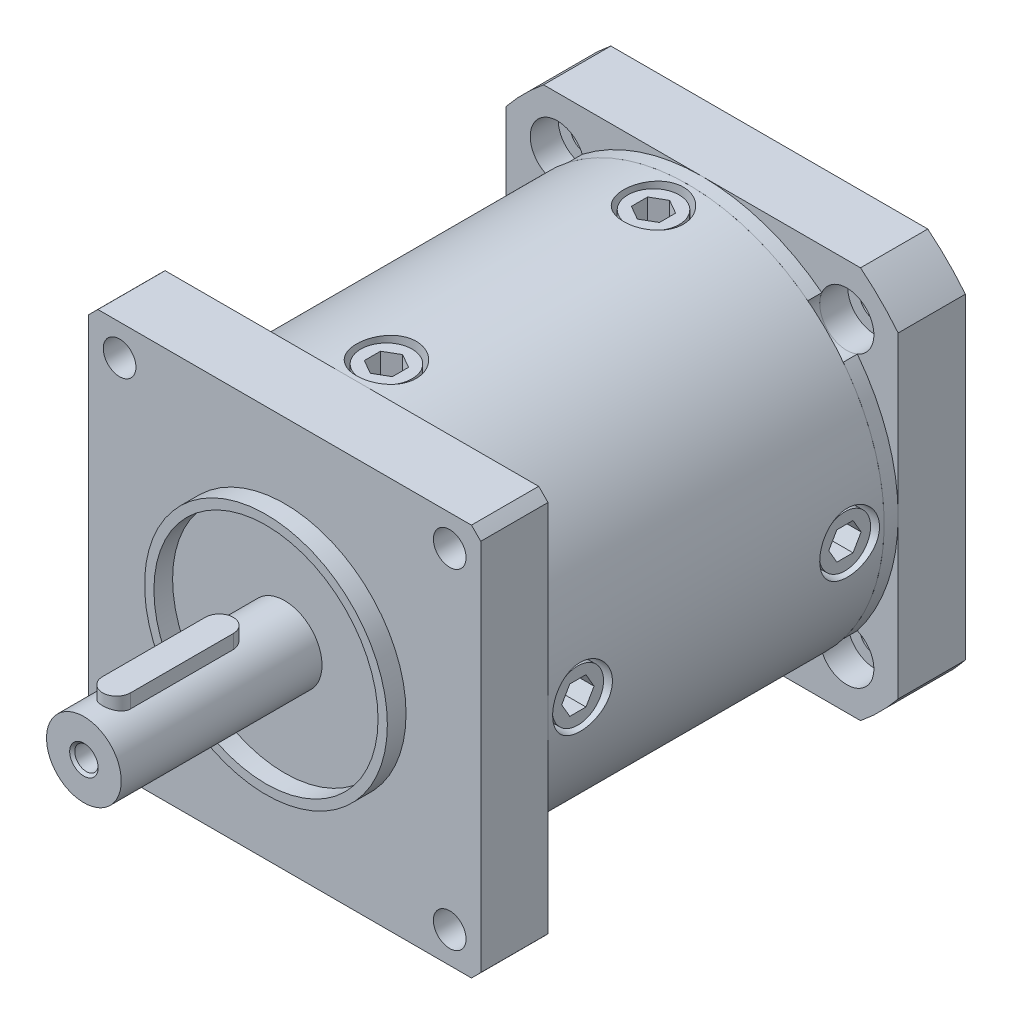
SolidWorks part; units mm, degrees
ref_plane "前视基准面" through (0, 0, 0) normal (0, 0, 1) x (1, 0, 0)
ref_plane "上视基准面" through (0, 0, 0) normal (0, 1, 0) x (1, 0, 0)
ref_plane "右视基准面" through (0, 0, 0) normal (1, 0, 0) x (0, 0, -1)
sketch "草图1" plane through (0, 0, 0) normal (0, 0, 1) x (1, 0, 0)
  line L1 (-20, -21) -> (20, -21)
  line L2 (-21, -20) -> (-21, 20)
  line L3 (-20, 21) -> (20, 21)
  line L4 (21, -20) -> (21, 20)
  line L5 (0, 21) -> (0, -21) construction
  line L6 (-21, 0) -> (21, 0) construction
  arc A0 (-20, 21) -> (-21, 20) centre (0, 0) ccw
  arc A1 (21, 20) -> (20, 21) centre (0, 0) ccw
  arc A2 (20, -21) -> (21, -20) centre (0, 0) ccw
  arc A3 (-21, -20) -> (-20, -21) centre (0, 0) ccw
  arc A4 (-21, -13.5647) -> (-21, 13.5647) centre (0, 0) ccw construction
  circle A5 centre (-17.6777, 17.6777) radius 1.75
  circle A6 centre (17.6777, 17.6777) radius 1.75
  circle A7 centre (17.6777, -17.6777) radius 1.75
  circle A8 centre (-17.6777, -17.6777) radius 1.75
  point P0 (0, 0)
  point P25 (0, 0)
  dimension "D3" = 3.5
  dimension "D4" = 4
extrude "凸台-拉伸2" add sketch "草图1" along normal blind 7.2
sketch "草图15" plane through (0, 0, 0) normal (0, 0, -1) x (-1, 0, 0)
  circle A0 centre (0, 0) radius 21
  dimension "D1" = 42
extrude "凸台-拉伸8" add sketch "草图15" along normal blind 36
sketch "草图17" plane through (0, 0, 7.2) normal (0, 0, 1) x (1, 0, 0)
  circle A0 centre (0, 0) radius 13
  circle A1 centre (0, 0) radius 12
  dimension "D1" = 26
  dimension "D2" = 24
extrude "凸台-拉伸9" add sketch "草图17" along normal blind 2
sketch "草图18" plane through (0, 0, 7.2) normal (0, 0, 1) x (1, 0, 0)
  circle A0 centre (0, 0) radius 4
  dimension "D1" = 8
extrude "凸台-拉伸10" add sketch "草图18" along normal blind 21.5
hole_wizard "M3 螺纹孔1" positions "草图22" profile "草图23" tap size "M3" standard "GB"
sketch "草图22" plane through (0, 0, 28.7) normal (0, 0, 1) x (1, 0, 0)
  point P0 (0, 0)
sketch "草图23" plane through (0, 0, 28.7) normal (1, 0, 0) x (0, -1, 0)
  line L0 (0, 0) -> (0, 11.7511)
  line L1 (0, 11.7511) -> (1.25, 11)
  line L2 (1.25, 11) -> (1.25, 0.275)
  line L3 (1.25, 0.275) -> (1.525, 0)
  line L5 (1.525, 0) -> (0, 0)
  line L6 (-1.25, 0.275) -> (-1.525, 0) construction
  line L10 (0, 11.7511) -> (-1.25, 11) construction
  line L11 (0, -6.35) -> (0, 107.95) construction
  dimension "螺纹孔钻头直径" = 2.5
  dimension "螺纹孔钻头深度" = 11
  dimension "近端锥形沉头孔直径" = 3.05
  dimension "近端锥形沉头孔角度" = 90
  dimension "导头角度" = 118
sketch "草图24" plane through (0, 0, 0) normal (0, 1, 0) x (1, 0, 0)
  line L0 (0, -14.2) -> (0, -25.2) construction
  line L2 (1.5, -14.2) -> (1.5, -25.2)
  line L3 (-1.5, -14.2) -> (-1.5, -25.2)
  line L4 (-4, -28.7) -> (4, -28.7) construction
  arc A0 (1.5, -14.2) -> (-1.5, -14.2) centre (0, -14.2) ccw
  arc A1 (-1.5, -25.2) -> (1.5, -25.2) centre (0, -25.2) ccw
  point P5 (0, -19.7)
  dimension "D1" = 3
  dimension "D2" = 11
  dimension "D3" = 3.5
extrude "凸台-拉伸11" add sketch "草图24" along normal blind 3 from offset 2.2
sketch "草图25" plane through (0, 0, -36) normal (0, 0, -1) x (-1, 0, 0)
  circle A0 centre (0, 0) radius 21
  dimension "D1" = 42
extrude "凸台-拉伸12" add sketch "草图25" along normal blind 1.5 separate body
sketch "草图26" plane through (0, 0, -37.5) normal (0, 0, -1) x (-1, 0, 0)
  line L1 (-16.9706, 21) -> (16.9706, 21)
  line L2 (-21, 16.9706) -> (-21, -16.9706)
  line L3 (-16.9706, -21) -> (16.9706, -21)
  line L4 (21, 16.9706) -> (21, -16.9706)
  line L5 (0, -21) -> (0, 21) construction
  line L6 (-21, 0) -> (21, 0) construction
  line L7 (-15.5, 15.5) -> (15.5, 15.5) construction
  line L8 (-15.5, 15.5) -> (-15.5, -15.5) construction
  line L9 (-15.5, -15.5) -> (15.5, -15.5) construction
  line L10 (15.5, 15.5) -> (15.5, -15.5) construction
  line L11 (0, -15.5) -> (0, 15.5) construction
  line L12 (-15.5, 0) -> (15.5, 0) construction
  arc A0 (16.9706, -21) -> (21, -16.9706) centre (0, 0) ccw
  arc A1 (-21, -16.9706) -> (-16.9706, -21) centre (0, 0) ccw
  arc A2 (-16.9706, 21) -> (-21, 16.9706) centre (0, 0) ccw
  arc A3 (21, 16.9706) -> (16.9706, 21) centre (0, 0) ccw
  circle A4 centre (-15.5, 15.5) radius 1.6
  circle A5 centre (15.5, 15.5) radius 1.6
  circle A6 centre (15.5, -15.5) radius 1.6
  circle A7 centre (-15.5, -15.5) radius 1.6
  point P0 (0, 0)
  point P22 (0, 0)
  dimension "D3" = 54
  dimension "D4" = 3.2
  dimension "D1" = 31
  dimension "D2" = 31
  dimension "D5" = 4
extrude "凸台-拉伸13" add sketch "草图26" along normal blind 7.2 separate body
sketch "草图27" plane through (0, 0, -44.7) normal (0, 0, -1) x (-1, 0, 0)
  circle A0 centre (0, 0) radius 11
  dimension "D1" = 22
extrude "切除-拉伸1" cut sketch "草图27" against normal blind 3
sketch "草图28" plane through (0, 0, -41.7) normal (0, 0, -1) x (-1, 0, 0)
  circle A0 centre (0, 0) radius 10
  dimension "D1" = 20
extrude "切除-拉伸2" cut sketch "草图28" against normal blind 10
sketch "草图29" plane through (0, 0, -31.7) normal (0, 0, -1) x (-1, 0, 0)
  circle A0 centre (0, 0) radius 7.5
  dimension "D1" = 15
extrude "凸台-拉伸14" add sketch "草图29" along normal blind 8 separate body
sketch "草图30" plane through (0, 0, -39.7) normal (0, 0, -1) x (-1, 0, 0)
  line L1 (-1.5, 2) -> (1.5, 2)
  arc A0 (-1.5, 2) -> (1.5, 2) centre (0, 0) ccw
  point P8 (0, 2)
  dimension "D1" = 5
extrude "切除-拉伸3" cut sketch "草图30" against normal blind 7
hole_wizard "M3 螺纹孔2" positions "草图32" profile "草图33" tap size "M3" standard "GB"
sketch "草图32" plane through (0, 2, 0) normal (0, -1, 0) x (-1, 0, 0)
  point P0 (0, 36.5869)
  point P1 (0, 33.1684)
  point P2 (0, 36.5869)
sketch "草图33" plane through (0, 2, -36.5869) normal (1, 0, 0) x (0, 0, -1)
  line L0 (0, 0) -> (0, 8.2511)
  line L1 (0, 8.2511) -> (1.25, 7.5)
  line L2 (1.25, 7.5) -> (1.25, 0)
  line L5 (1.25, 0) -> (0, 0)
  line L10 (0, 8.2511) -> (-1.25, 7.5) construction
  line L11 (0, -6.35) -> (0, 107.95) construction
  dimension "螺纹孔钻头直径" = 2.5
  dimension "螺纹孔钻头深度" = 7.5
  dimension "导头角度" = 118
sketch "草图37" plane through (0, 0, -36) normal (0, 0, 1) x (1, 0, 0)
  circle A0 centre (15.5, 15.5) radius 2.9
  circle A1 centre (15.5, -15.5) radius 2.9
  circle A2 centre (-15.5, -15.5) radius 2.9
  circle A3 centre (-15.5, 15.5) radius 2.9
  point P11 (0, 0)
  dimension "D1" = 5.8
  dimension "D2" = 4
extrude "切除-拉伸4" cut sketch "草图37" against normal blind 4.5
sketch "草图38" plane through (21, 0, 0) normal (1, 0, 0) x (0, 0, -1)
  line L4 (0, -20) -> (0, 0) construction
  line L7 (36, -21) -> (36, 21) construction
  circle A0 centre (3.7, 0) radius 3.2
  circle A1 centre (32.3, 0) radius 3.2
  dimension "D1" = 0.5
  dimension "D2" = 6.4
  dimension "D3" = 0.5
  dimension "D4" = 6.4
extrude "切除-拉伸5" cut sketch "草图38" against normal blind 3.5
sketch "草图39" plane through (17.5, 0, 0) normal (1, 0, 0) x (0, 0, -1)
  circle A0 centre (3.7, 0) radius 2.75
  circle A1 centre (32.3, 0) radius 2.75
  dimension "D1" = 5.5
  dimension "D2" = 5.5
extrude "凸台-拉伸15" add sketch "草图39" along normal blind 3
sketch "草图40" plane through (20.5, 0, 0) normal (1, 0, 0) x (0, 0, -1)
  line L1 (5.4321, 0) -> (4.566, 1.5)
  line L2 (4.566, 1.5) -> (2.834, 1.5)
  line L3 (2.834, 1.5) -> (1.9679, 0)
  line L4 (1.9679, 0) -> (2.834, -1.5)
  line L5 (2.834, -1.5) -> (4.566, -1.5)
  line L6 (4.566, -1.5) -> (5.4321, 0)
  line L7 (30.5679, 0) -> (31.434, -1.5)
  line L8 (31.434, -1.5) -> (33.166, -1.5)
  line L9 (33.166, -1.5) -> (34.0321, 0)
  line L10 (34.0321, 0) -> (33.166, 1.5)
  line L11 (33.166, 1.5) -> (31.434, 1.5)
  line L12 (31.434, 1.5) -> (30.5679, 0)
  circle A0 centre (3.7, 0) radius 1.5 construction
  circle A1 centre (32.3, 0) radius 1.5 construction
  dimension "D1" = 3
  dimension "D2" = 3
extrude "切除-拉伸6" cut sketch "草图40" against normal blind 3
pattern_circular "阵列(圆周)1" count 4 every 90 about axis through (0, 0, 0) along (0, 0, 1) of "切除-拉伸6", "凸台-拉伸15", "切除-拉伸5"
